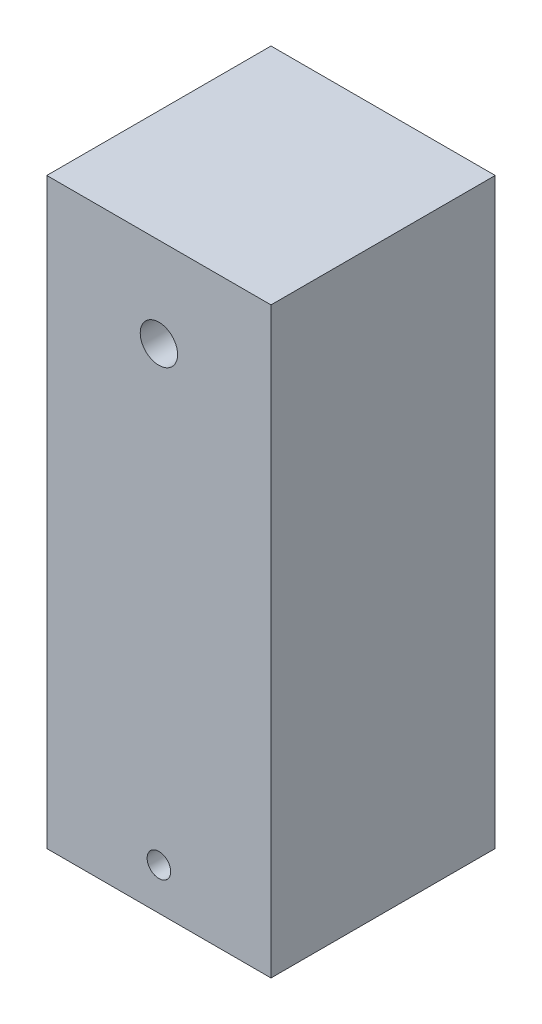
SolidWorks part; units mm, degrees
ref_plane "Front Plane" through (0, 0, 0) normal (0, 0, 1) x (1, 0, 0)
ref_plane "Top Plane" through (0, 0, 0) normal (0, 1, 0) x (1, 0, 0)
ref_plane "Right Plane" through (0, 0, 0) normal (1, 0, 0) x (0, 0, -1)
sketch "Sketch1" plane through (0, 0, 0) normal (0, 0, 1) x (1, 0, 0)
  line L0 (0, 24.765) -> (0, -24.765) construction
  line L1 (-9.525, -24.765) -> (9.525, -24.765)
  line L2 (-9.525, -24.765) -> (-9.525, 24.765)
  line L3 (-9.525, 24.765) -> (9.525, 24.765)
  line L4 (9.525, -24.765) -> (9.525, 24.765)
  line L5 (-9.525, -24.765) -> (9.525, 24.765) construction
  line L6 (-9.525, 24.765) -> (9.525, -24.765) construction
  circle A0 centre (0, 17.145) radius 1.5875
  point P1 (0, 0)
  dimension "D4" = 3.175
  dimension "D1" = 49.53
  dimension "D2" = 19.05
  dimension "D3" = 7.62
extrude "Boss-Extrude1" add sketch "Sketch1" along normal blind 19.05
sketch "Sketch3" plane through (0, 0, 0) normal (0, 0, -1) x (-1, 0, 0)
  line L0 (9.525, -17.653) -> (-9.2288, -17.653) construction
  line L1 (9.525, 24.765) -> (9.525, -24.765) construction
  line L2 (9.525, -24.765) -> (-9.525, -24.765) construction
  line L3 (9.525, -21.209) -> (-9.525, -21.209) construction
  line L4 (-9.525, -24.765) -> (-9.525, 24.765) construction
  line L5 (0, -24.765) -> (0, -17.653) construction
  circle A0 centre (0, -21.209) radius 1
  dimension "D3" = 2
  dimension "D1" = 7.112
  dimension "D2" = 3.556
extrude "Cut-Extrude2" cut sketch "Sketch3" against normal through all
